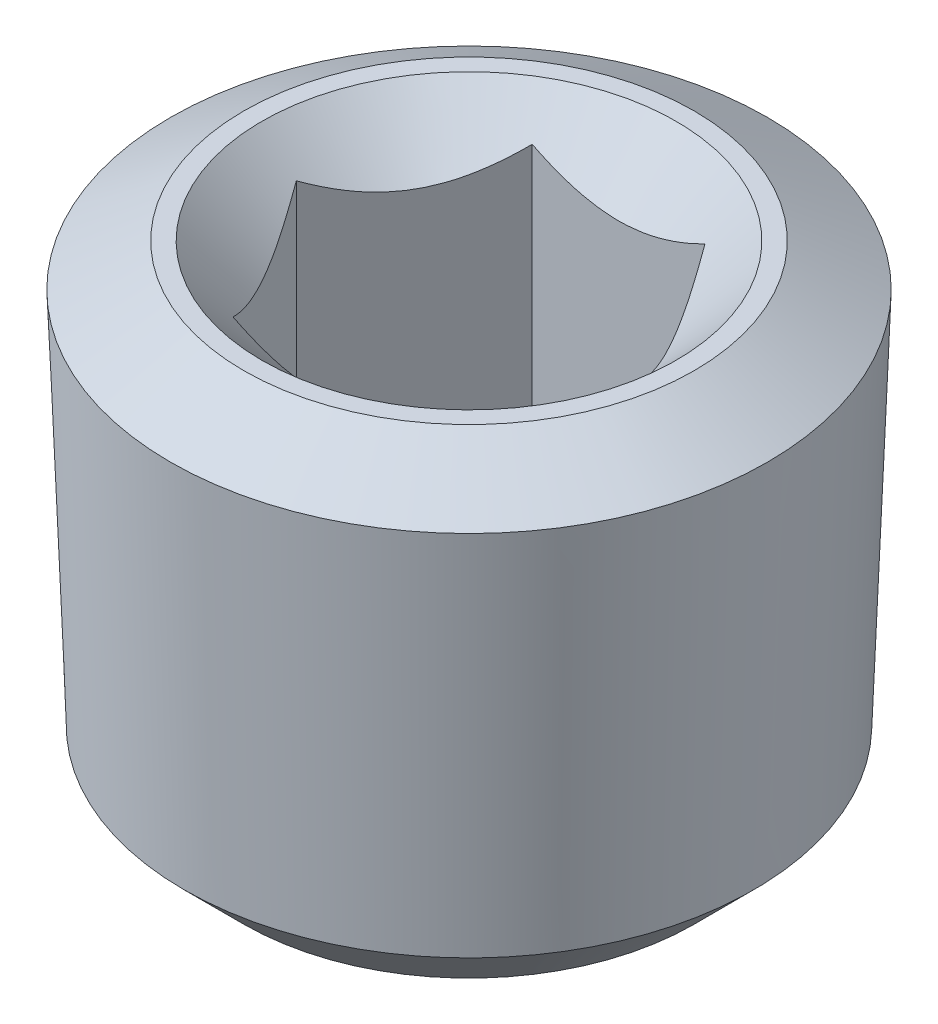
SolidWorks part; units mm, degrees
ref_plane "Front Plane" through (0, 0, 0) normal (0, 0, 1) x (1, 0, 0)
ref_plane "Top Plane" through (0, 0, 0) normal (0, 1, 0) x (1, 0, 0)
ref_plane "Right Plane" through (0, 0, 0) normal (1, 0, 0) x (0, 0, -1)
sketch "Sketch2" plane through (0, 0, 0) normal (0, 0, 1) x (1, 0, 0)
  line L0 (0, 10.7443) -> (0, -17.0657) construction
  line L1 (0, 0) -> (-2.9816, 0)
  line L2 (-3.9546, -0.5618) -> (-3.7724, -5.5592)
  line L3 (-2.9816, -6.35) -> (0, -6.35)
  line L4 (0, -6.35) -> (0, 0)
  line L6 (-2.9816, -6.35) -> (-3.7724, -5.5592)
  line L7 (-2.9816, 0) -> (-3.9546, -0.5618)
  point P4 (-3.9751, 0)
  point P6 (-3.7436, -6.35)
  dimension "D1" = 6.35
  dimension "D2" = 2.088
  dimension "D3" = 7.9502
  dimension "D4" = 30
  dimension "D5" = 0.762
  dimension "D6" = 45
  dimension "D7" = 7.4872
revolve "Revolve1" add sketch "Sketch2" angle 360 about L0
sketch "Sketch3" plane through (0, 0, 0) normal (0, 0, 1) x (1, 0, 0)
  line L0 (0, 2.9342) -> (0, -8.1202) construction
  line L1 (0, 0) -> (-2.7432, 0)
  line L2 (2.9816, 0) -> (-2.9816, 0) construction
  line L3 (-1.9812, -0.762) -> (-1.9812, -3.81)
  line L4 (-1.9812, -3.81) -> (0, -5.0004)
  line L5 (0, -5.0004) -> (0, 0)
  line L6 (-1.9812, -0.762) -> (-2.7432, 0)
  dimension "D1" = 3.81
  dimension "D2" = 59
  dimension "D3" = 3.9624
  dimension "D4" = 0.762
  dimension "D5" = 45
revolve "Cut-Revolve1" cut sketch "Sketch3" angle 360 about L0
sketch "Sketch4" plane through (0, 0, 0) normal (0, 1, 0) x (1, 0, 0)
  line L1 (-1.1438, -1.9812) -> (1.1438, -1.9812)
  line L2 (1.1438, -1.9812) -> (2.2877, 0)
  line L3 (2.2877, 0) -> (1.1438, 1.9812)
  line L4 (1.1438, 1.9812) -> (-1.1438, 1.9812)
  line L5 (-1.1438, 1.9812) -> (-2.2877, 0)
  line L6 (-2.2877, 0) -> (-1.1438, -1.9812)
  circle A0 centre (0, 0) radius 1.9812 construction
  circle A1 centre (0, 0) radius 1.9812 construction
extrude "Cut-Extrude1" cut sketch "Sketch4" against normal up to vertex (5.2929 mm away)
